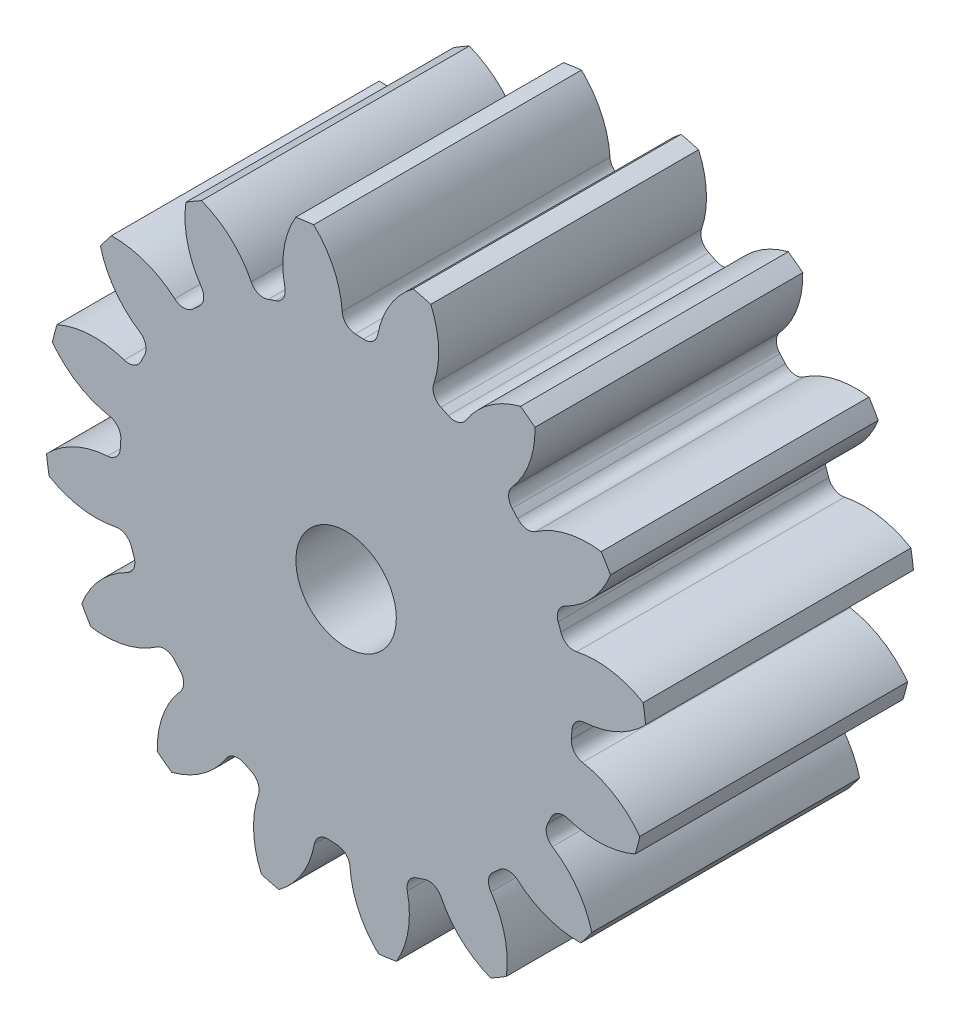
SolidWorks part; units mm, degrees
ref_plane "Front" through (0, 0, 0) normal (0, 0, 1) x (1, 0, 0)
ref_plane "Top" through (0, 0, 0) normal (0, 1, 0) x (1, 0, 0)
ref_plane "Right" through (0, 0, 0) normal (1, 0, 0) x (0, 0, -1)
sketch "Sketch3" plane through (0, 0, 0) normal (0, 0, 1) x (1, 0, 0)
  circle A0 centre (0, 0) radius 114.3
  dimension "od" = 228.6
extrude "gearBody" add sketch "Sketch3" along normal blind 101.6
sketch "Sketch2" plane through (0, 0, 0) normal (0, 0, 1) x (1, 0, 0)
  line L0 (0, 0) -> (88.2053, 36.5358) construction
  line L1 (112.003, -26.2556) -> (0, 0) construction
  line L2 (0, 0) -> (36.3143, 0) construction
  line L3 (101.52, 4.0305) -> (100.3582, -15.8367) construction
  line L5 (100.9391, -5.9031) -> (0, 0) construction
  line L7 (0, 0) -> (95.4728, 0) construction
  arc A0 (95.4482, 2.1641) -> (94.5453, -13.2752) centre (0, 0) ccw construction
  arc A1 (113.6358, 12.3043) -> (111.4269, -25.4663) centre (0, 0) ccw construction
  arc A2 (101.52, 4.0305) -> (100.3582, -15.8367) centre (0, 0) ccw construction
  arc A3 (85.475, -6.5422) -> (85.6549, -3.4658) centre (0, 0) ccw
  arc A4 (112.003, -26.2556) -> (89.6945, -12.0204) centre (83.3453, -46.5684) ccw
  arc A5 (112.003, -26.2556) -> (114.3, 13.021) centre (0, 0) ccw
  arc A6 (114.3, 13.021) -> (90.4842, 1.4833) centre (88.2053, 36.5358) cw
  arc A7 (85.6549, -3.4658) -> (90.4842, 1.4833) centre (90.8196, -3.6748) cw
  arc A8 (89.6945, -12.0204) -> (85.475, -6.5422) centre (90.6288, -6.9366) cw
  point P6 (114.3, 13.021)
  point P22 (112.003, -26.2556)
  dimension "baseDia" = 190.9455
  dimension "od" = 228.6
  dimension "pd" = 203.2
  dimension "rd" = 171.45
  dimension "rFillet" = 5.1689
  dimension "pointX" = 114.3
  dimension "pointY" = 13.021
  dimension "CTT" = 19.8672
  dimension "flankCenterAngle" = 22.5
extrude "toothCut" cut sketch "Sketch2" along normal through all
pattern_circular "CirPattern1" count 16 over 360 about axis through (0, 0, 0) along (0, 0, 1) of "toothCut"
sketch "hub1Dia" plane through (0, 0, 0) normal (0, 0, -1) x (-1, 0, 0)
  circle A0 centre (0, 0) radius 12.7
  dimension "hub1Dia" = 25.4
sketch "hub2Dia" plane through (0, 0, 101.6) normal (0, 0, 1) x (1, 0, 0)
  circle A0 centre (0, 0) radius 12.7
  dimension "hub2dia" = 25.4
sketch "boreDia" plane through (0, 0, 0) normal (0, 0, 1) x (1, 0, 0)
  circle A0 centre (0, 0) radius 19.05
  dimension "boreDia" = 38.1
extrude "bore" cut sketch "boreDia" against normal mid plane 25400
